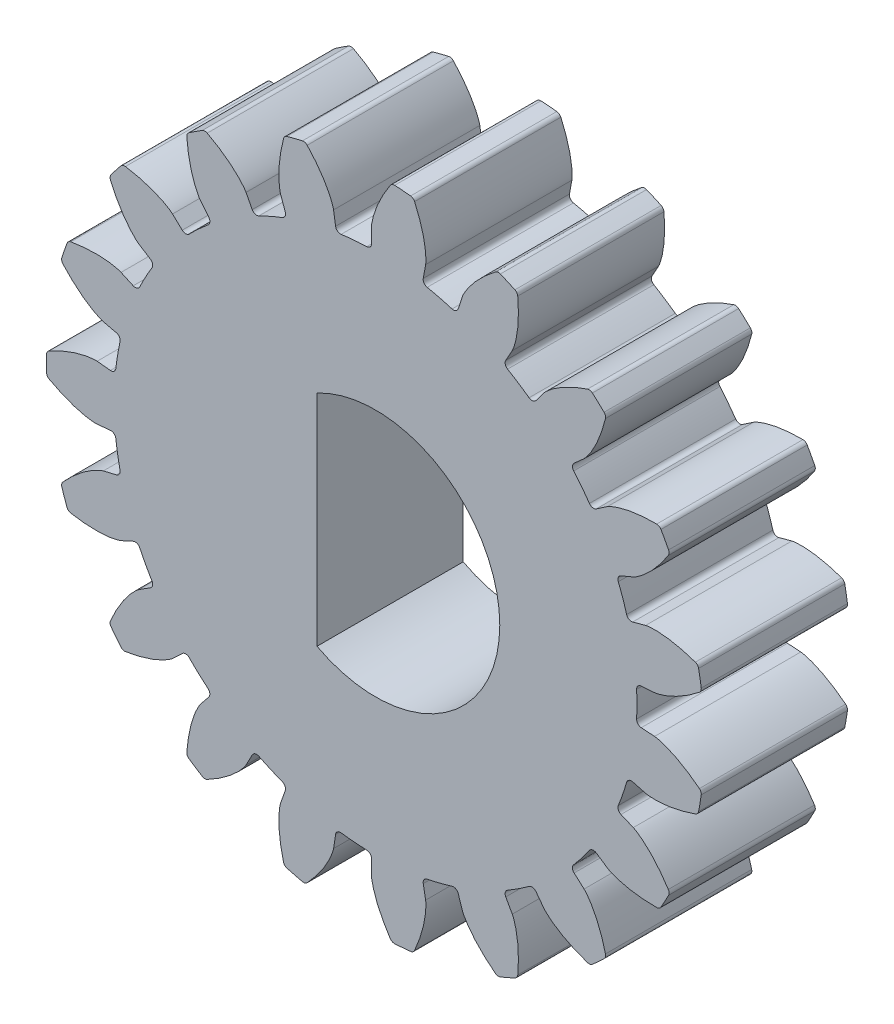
SolidWorks part; units mm, degrees
ref_plane "Front Plane" through (0, 0, 0) normal (0, 0, 1) x (1, 0, 0)
ref_plane "Top Plane" through (0, 0, 0) normal (0, 1, 0) x (1, 0, 0)
ref_plane "Right Plane" through (0, 0, 0) normal (1, 0, 0) x (0, 0, -1)
sketch "Sketch10" plane through (0, 0, 0) normal (0, 0, 1) x (1, 0, 0)
  circle A0 centre (0, 0) radius 22.5
  circle A1 centre (0, 0) radius 1.25
  dimension "D1" = 2.5
  dimension "D2" = 45
extrude "Boss-Extrude5" add sketch "Sketch10" along normal blind 10
sketch "Sketch11" plane through (0, 0, 10) normal (0, 0, 1) x (1, 0, 0)
  line L0 (0, 0) -> (17.88, 0) construction
  line L3 (17.88, 0) -> (22.5005, 0)
  line L4 (0, 0) -> (17.839, 1.2108) construction
  line L5 (19.0859, 1.2954) -> (17.839, 1.2108)
  circle A0 centre (0, 0) radius 17.88 construction
  circle A1 centre (0, 0) radius 19.13 construction
  circle A2 centre (0, 0) radius 20.36 construction
  circle A11 centre (0, 0) radius 22.5005 construction
  arc A12 (22.5005, 0) -> (22.3031, 2.9739) centre (0, 0) ccw
  arc A13 (17.88, 0) -> (17.839, 1.2108) centre (0, 0) ccw
  spline S0 degree 4 poles (19.0859, 1.2954) (19.0913, 1.2959) (19.1065, 1.2973) (19.135, 1.3009) (19.1815, 1.308) (19.2405, 1.3189) (19.3165, 1.335) (19.4057, 1.3566) (19.5032, 1.3831) (19.6089, 1.415) (19.7138, 1.4494) (19.8179, 1.4861) (19.9212, 1.5249) (20.0458, 1.5745) (20.1943, 1.6376) (20.3667, 1.7165) (20.5606, 1.8121) (20.7565, 1.9161) (20.9477, 2.0237) (21.139, 2.1386) (21.3228, 2.254) (21.5117, 2.38) (21.685, 2.4995) (21.8768, 2.6401) (22.0309, 2.7556) (22.2316, 2.915) (22.3493, 3.0113) (22.4861, 3.1265) (22.5464, 3.1789) (22.5835, 3.2111) knots 0 0 0 0 0 0.005377 0.015084 0.028532 0.04661 0.064855 0.092111 0.119476 0.146842 0.174209 0.201575 0.228941 0.256307 0.307035 0.361767 0.4165 0.471232 0.525964 0.580697 0.635429 0.690161 0.744894 0.799626 0.854358 0.909091 0.954545 1 1 1 1 1 construction
  spline S1 degree 4 poles (19.0859, 1.2954) (19.0913, 1.2959) (19.1065, 1.2973) (19.135, 1.3009) (19.1815, 1.308) (19.2405, 1.3189) (19.3165, 1.335) (19.4057, 1.3566) (19.5032, 1.3831) (19.6089, 1.415) (19.7138, 1.4494) (19.8179, 1.4861) (19.9212, 1.5249) (20.0458, 1.5745) (20.1943, 1.6376) (20.3667, 1.7165) (20.5606, 1.8121) (20.7565, 1.9161) (20.9477, 2.0237) (21.139, 2.1386) (21.3228, 2.254) (21.5117, 2.38) (21.685, 2.4995) (21.8768, 2.6401) (22.0309, 2.7556) (22.1881, 2.8805) (22.2643, 2.9421) (22.3031, 2.9739) knots 0 0 0 0 0 0.005377 0.015084 0.028532 0.04661 0.064855 0.092111 0.119476 0.146842 0.174209 0.201575 0.228941 0.256307 0.307035 0.361767 0.4165 0.471232 0.525964 0.580697 0.635429 0.690161 0.744894 0.799626 0.854358 0.909091 0.909091 0.909091 0.909091 0.909091
  dimension "D1" = 40.72
  dimension "D2" = 38.26
  dimension "D3" = 35.76
extrude "Cut-Extrude1" cut sketch "Sketch11" against normal through all
mirror "Mirror1" about plane through (17.88, 0, 0) normal (0, -1, 0) of "Cut-Extrude1"
fillet "Fillet1" radius 0.34 4 edges at (17.839, -1.2108, 5) (22.3026, -2.9735, 5) (22.3026, 2.9735, 5) (17.839, 1.2108, 5)
pattern_circular "CirPattern1" count 19 over 360 about axis through (0, 0, 10) along (0, 0, -1) of "Cut-Extrude1", "Mirror1", "Fillet1"
sketch "Sketch12" plane through (0, 0, 10) normal (0, 0, 1) x (1, 0, 0)
  line L0 (-2.8, 0) -> (-4, 0) construction
  line L1 (-4, 0) -> (-4, 7.5)
  line L2 (-4, 0) -> (-4, -7.5)
  arc A0 (-4, -7.5) -> (-4, 7.5) centre (0, 0) ccw
  circle A1 centre (0, 0) radius 2.8 construction
  point P6 (0, 0)
  dimension "D1" = 17
  dimension "D2" = 5.6
  dimension "D3" = 1.2
extrude "Cut-Extrude2" cut sketch "Sketch12" against normal through all
equation "\"P\"= 0.466657"
equation "\"z\" = 19"
equation "\"α\"= 20"
equation "\"s\"= 5"
equation "\"D_b\"= 2.5"
equation "\"c\"= 0.157 / \"P\""
equation "\"D_p\"= \"z\" / \"P\""
equation "\"D_base\"= \"D_p\" * cos ( \"α\" )"
equation "\"h_a\"= 1 / \"P\""
equation "\"h_d\"= 1 / \"P\" + \"c\""
equation "\"P_c\"= pi / \"P\""
equation "\"D_a\"= \"D_p\" + ( 2 * \"h_a\" )"
equation "\"D_d\"= \"D_p\" - ( 2 * \"h_d\" )"
equation "\"φ\"= 360 / \"z\""
equation "\"α_inv\"= ( ( \"D_p\" ^ 2 - \"D_base\" ^ 2 ) ^ 0.5 / \"D_base\" ) * 180 / pi - \"α\""
equation "\"β_inv\"= ( \"φ\" / 4 ) - \"α_inv\""
equation "\"ζ\"= ( ( \"D_a\" / 2 ) ^ 2 - ( \"D_base\" / 2 ) ^ 2 ) ^ 0.5 * 2 / \"D_base\""
